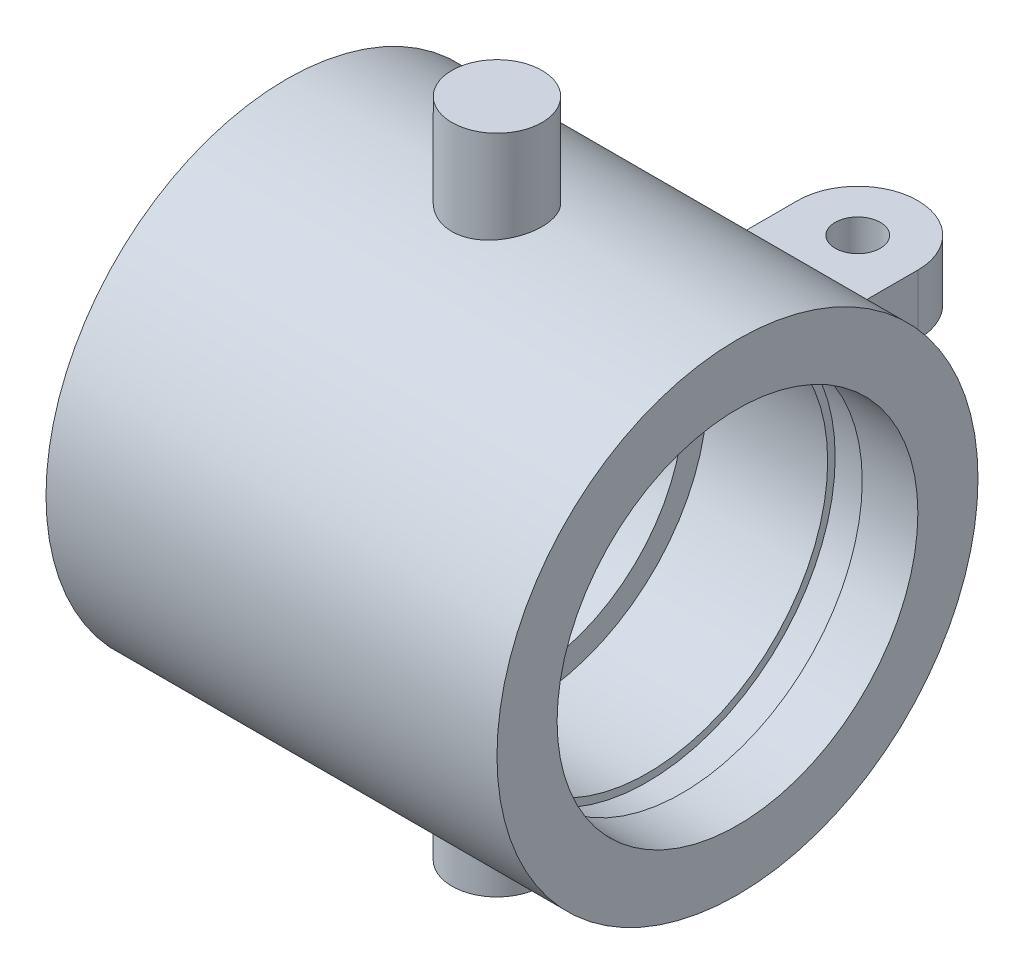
SolidWorks part; units mm, degrees
ref_plane "正面" through (0, 0, 0) normal (0, 0, 1) x (1, 0, 0)
ref_plane "平面" through (0, 0, 0) normal (0, 1, 0) x (1, 0, 0)
ref_plane "右側面" through (0, 0, 0) normal (1, 0, 0) x (0, 0, -1)
body saved out of another part "ｽﾄｯｸ-フロント機構部-1"
